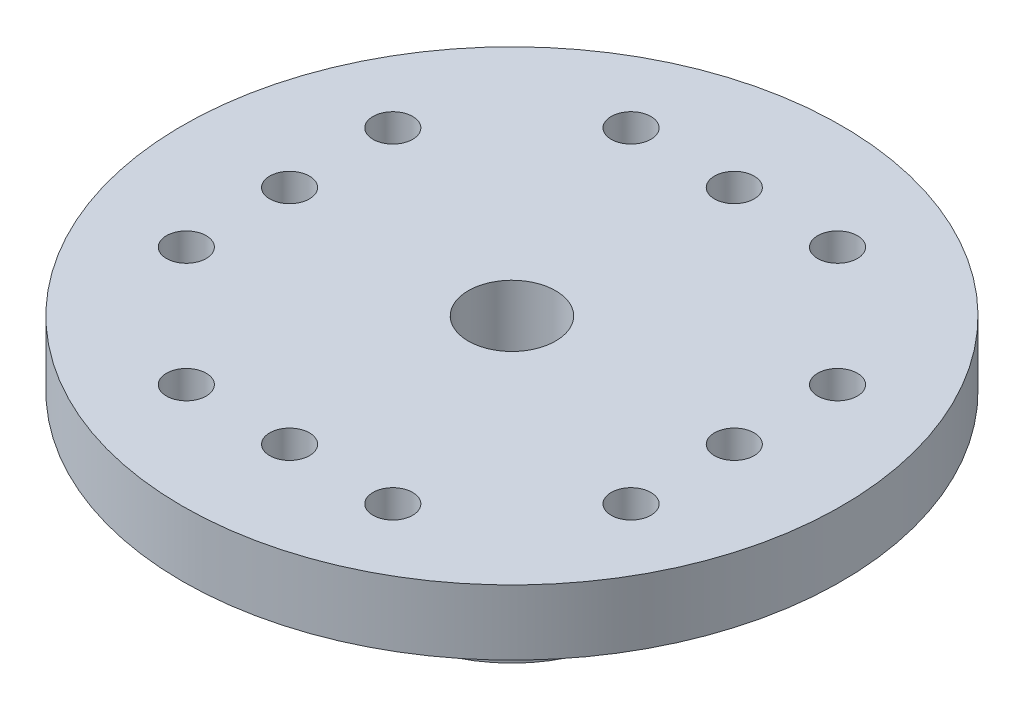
SolidWorks part; units mm, degrees
ref_plane "Front Plane" through (0, 0, 0) normal (0, 0, 1) x (1, 0, 0)
ref_plane "Top Plane" through (0, 0, 0) normal (0, 1, 0) x (1, 0, 0)
ref_plane "Right Plane" through (0, 0, 0) normal (1, 0, 0) x (0, 0, -1)
sketch "Sketch1" plane through (0, 0, 0) normal (0, 1, 0) x (1, 0, 0)
  circle A0 centre (0, 0) radius 3.8354
  circle A1 centre (0, 0) radius 3.048
  dimension "D1" = 7.6708
  dimension "D2" = 6.096
extrude "Boss-Extrude1" add sketch "Sketch1" along normal blind 4.826
sketch "Sketch2" plane through (0, 4.826, 0) normal (0, 1, 0) x (1, 0, 0)
  circle A0 centre (0, 0) radius 10.541
  dimension "D1" = 21.082
extrude "Boss-Extrude2" add sketch "Sketch2" along normal blind 2.0828
sketch "Sketch3" plane through (0, 6.9088, 0) normal (0, 1, 0) x (1, 0, 0)
  circle A0 centre (0, 0) radius 1.397
  dimension "D1" = 2.794
extrude "Cut-Extrude1" cut sketch "Sketch3" against normal through all
sketch "Sketch4" plane through (0, 6.9088, 0) normal (0, 1, 0) x (1, 0, 0)
  line L0 (-10.541, 0) -> (10.541, 0) construction
  line L1 (0, 10.541) -> (0, -10.541) construction
  line L2 (-7.112, 7.7802) -> (-7.112, -7.7802) construction
  line L3 (0, 0) -> (7.4536, -7.4536) construction
  circle A0 centre (0, 0) radius 10.541 construction
  circle A1 centre (-7.112, 0) radius 0.635
  circle A2 centre (-7.112, 3.302) radius 0.635
  circle A3 centre (-7.112, -3.302) radius 0.635
  circle A4 centre (7.112, -3.302) radius 0.635
  circle A5 centre (7.112, 0) radius 0.635
  circle A6 centre (7.112, 3.302) radius 0.635
  circle A7 centre (3.302, 7.112) radius 0.635
  circle A8 centre (0, 7.112) radius 0.635
  circle A9 centre (-3.302, 7.112) radius 0.635
  circle A10 centre (3.302, -7.112) radius 0.635
  circle A11 centre (-3.302, -7.112) radius 0.635
  circle A12 centre (0, -7.112) radius 0.635
  dimension "D2" = 1.27
  dimension "D3" = 1.27
  dimension "D4" = 1.27
  dimension "D1" = 7.112
  dimension "D5" = 3.302
  dimension "D6" = 3.302
  dimension "D7" = 45
extrude "Cut-Extrude2" cut sketch "Sketch4" against normal blind 2.0828
